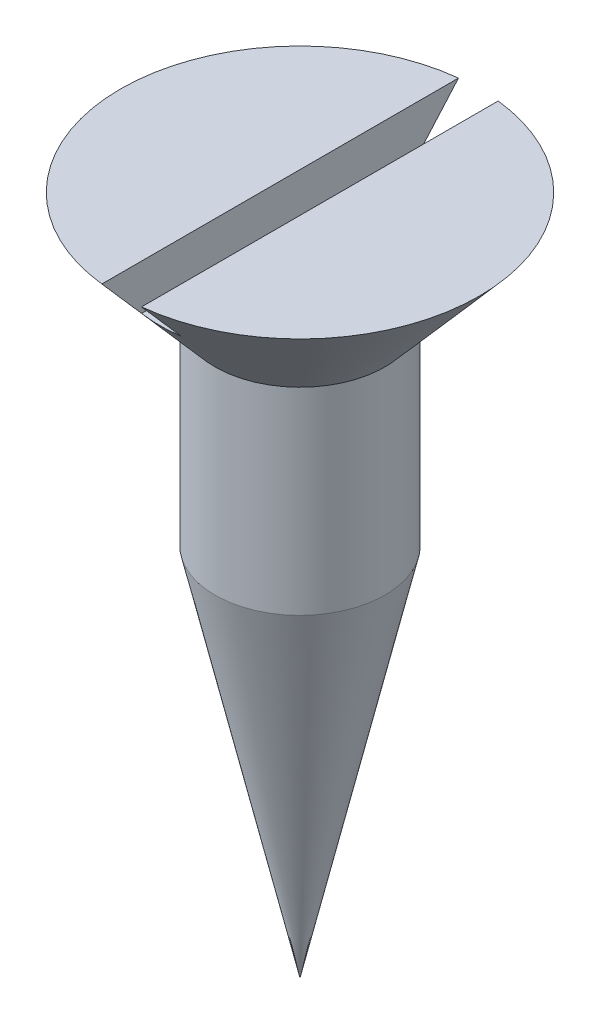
SolidWorks part; units mm, degrees
ref_plane "Front Plane" through (0, 0, 0) normal (0, 0, 1) x (1, 0, 0)
ref_plane "Top Plane" through (0, 0, 0) normal (0, 1, 0) x (1, 0, 0)
ref_plane "Right Plane" through (0, 0, 0) normal (1, 0, 0) x (0, 0, -1)
sketch "Sketch1" plane through (0, 0, 0) normal (0, 0, 1) x (1, 0, 0)
  line L0 (-12.4781, 0) -> (0, 0) construction
  line L1 (0, 0) -> (0, -32.6585) construction
  line L2 (0, 0) -> (0, -15.24)
  line L3 (0, -15.24) -> (-1.905, -6.858)
  line L4 (-1.905, -6.858) -> (-1.905, -2.4325)
  line L5 (-1.905, -2.4325) -> (-4.0196, 0)
  line L6 (-4.0196, 0) -> (0, 0)
  dimension "D1" = 3.81
  dimension "D2" = 15.24
  dimension "D3" = 8.382
  dimension "D4" = 41
  dimension "D5" = 8.0391
revolve "Revolve1" add sketch "Sketch1" angle 360 about L2
sketch "Sketch2" plane through (0, 0, 0) normal (0, 0, 1) x (1, 0, 0)
  line L1 (-0.4445, 1.016) -> (0.4445, 1.016)
  line L2 (-0.4445, 1.016) -> (-0.4445, -1.016)
  line L3 (-0.4445, -1.016) -> (0.4445, -1.016)
  line L4 (0.4445, 1.016) -> (0.4445, -1.016)
  line L5 (-0.4445, 1.016) -> (0.4445, -1.016) construction
  line L6 (-0.4445, -1.016) -> (0.4445, 1.016) construction
  point P0 (0, 0)
  dimension "D1" = 0.889
  dimension "D2" = 2.032
extrude "Cut-Extrude1" cut sketch "Sketch2" against normal through all both and the other way through all
